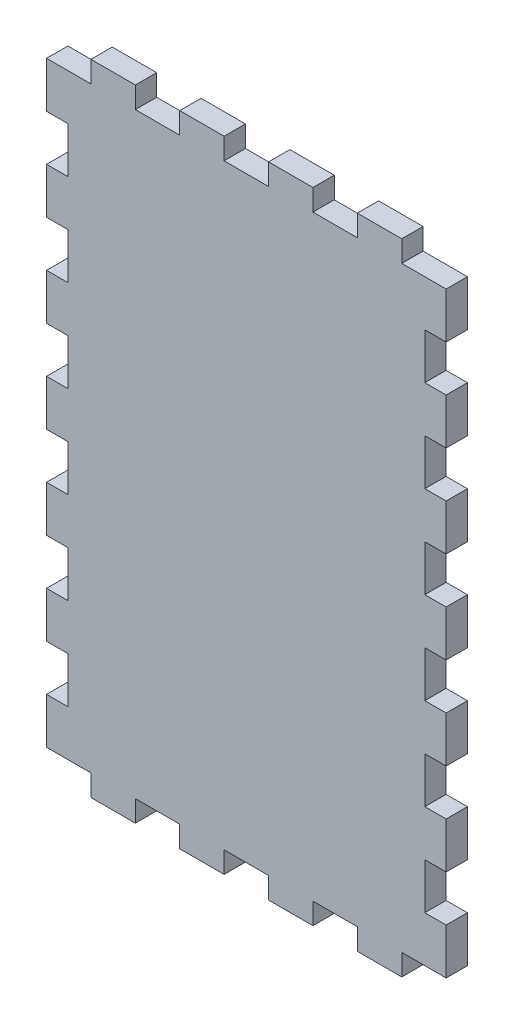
SolidWorks part; units mm, degrees
ref_plane "Front Plane" through (0, 0, 0) normal (0, 0, 1) x (1, 0, 0)
ref_plane "Top Plane" through (0, 0, 0) normal (0, 1, 0) x (1, 0, 0)
ref_plane "Right Plane" through (0, 0, 0) normal (1, 0, 0) x (0, 0, -1)
sketch "Model" plane through (0, 0, 0) normal (0, 0, 1) x (1, 0, 0)
  line L0 (83, 83) -> (87, 83)
  line L1 (87, 83) -> (87, 79)
  line L2 (87, 79) -> (95, 79)
  line L3 (95, 79) -> (95, 83)
  line L4 (95, 83) -> (103, 83)
  line L5 (103, 83) -> (103, 79)
  line L6 (103, 79) -> (111, 79)
  line L7 (111, 79) -> (111, 83)
  line L8 (111, 83) -> (119, 83)
  line L9 (119, 83) -> (119, 79)
  line L10 (119, 79) -> (127, 79)
  line L11 (127, 79) -> (127, 83)
  line L12 (127, 83) -> (135, 83)
  line L13 (135, 83) -> (135, 79)
  line L14 (135, 79) -> (143, 79)
  line L15 (143, 79) -> (143, 83)
  line L16 (143, 83) -> (151, 83)
  line L17 (151, 83) -> (151, 79)
  line L18 (151, 79) -> (159, 79)
  line L19 (159, 79) -> (159, 83)
  line L20 (159, 83) -> (167, 83)
  line L21 (167, 83) -> (167, 79)
  line L22 (167, 79) -> (175, 79)
  line L23 (175, 79) -> (175, 83)
  line L24 (175, 83) -> (183, 83)
  line L25 (183, 83) -> (183, 79)
  line L26 (183, 79) -> (191, 79)
  line L27 (191, 79) -> (191, 83)
  line L28 (191, 83) -> (195, 83)
  line L29 (195, 83) -> (195, 91.61)
  line L30 (195, 91.61) -> (199, 91.61)
  line L31 (199, 91.61) -> (199, 100.23)
  line L32 (199, 100.23) -> (195, 100.23)
  line L33 (195, 100.23) -> (195, 108.85)
  line L34 (195, 108.85) -> (199, 108.85)
  line L35 (199, 108.85) -> (199, 117.46)
  line L36 (199, 117.46) -> (195, 117.46)
  line L37 (195, 117.46) -> (195, 126.08)
  line L38 (195, 126.08) -> (199, 126.08)
  line L39 (199, 126.08) -> (199, 134.69)
  line L40 (199, 134.69) -> (195, 134.69)
  line L41 (195, 134.69) -> (195, 143.31)
  line L42 (195, 143.31) -> (199, 143.31)
  line L43 (199, 143.31) -> (199, 151.92)
  line L44 (199, 151.92) -> (195, 151.92)
  line L45 (195, 151.92) -> (195, 160.54)
  line L46 (195, 160.54) -> (199, 160.54)
  line L47 (199, 160.54) -> (199, 169.15)
  line L48 (199, 169.15) -> (195, 169.15)
  line L49 (195, 169.15) -> (195, 177.77)
  line L50 (195, 177.77) -> (199, 177.77)
  line L51 (199, 177.77) -> (199, 186.38)
  line L52 (199, 186.38) -> (195, 186.38)
  line L53 (195, 186.38) -> (195, 195)
  line L54 (195, 195) -> (191, 195)
  line L55 (191, 195) -> (191, 199)
  line L56 (191, 199) -> (183, 199)
  line L57 (183, 199) -> (183, 195)
  line L58 (183, 195) -> (175, 195)
  line L59 (175, 195) -> (175, 199)
  line L60 (175, 199) -> (167, 199)
  line L61 (167, 199) -> (167, 195)
  line L62 (167, 195) -> (159, 195)
  line L63 (159, 195) -> (159, 199)
  line L64 (159, 199) -> (151, 199)
  line L65 (151, 199) -> (151, 195)
  line L66 (151, 195) -> (143, 195)
  line L67 (143, 195) -> (143, 199)
  line L68 (143, 199) -> (135, 199)
  line L69 (135, 199) -> (135, 195)
  line L70 (135, 195) -> (127, 195)
  line L71 (127, 195) -> (127, 199)
  line L72 (127, 199) -> (119, 199)
  line L73 (119, 199) -> (119, 195)
  line L74 (119, 195) -> (111, 195)
  line L75 (111, 195) -> (111, 199)
  line L76 (111, 199) -> (103, 199)
  line L77 (103, 199) -> (103, 195)
  line L78 (103, 195) -> (95, 195)
  line L79 (95, 195) -> (95, 199)
  line L80 (95, 199) -> (87, 199)
  line L81 (87, 199) -> (87, 195)
  line L82 (87, 195) -> (83, 195)
  line L83 (83, 195) -> (83, 186.38)
  line L84 (83, 186.38) -> (79, 186.38)
  line L85 (79, 186.38) -> (79, 177.77)
  line L86 (79, 177.77) -> (83, 177.77)
  line L87 (83, 177.77) -> (83, 169.15)
  line L88 (83, 169.15) -> (79, 169.15)
  line L89 (79, 169.15) -> (79, 160.54)
  line L90 (79, 160.54) -> (83, 160.54)
  line L91 (83, 160.54) -> (83, 151.92)
  line L92 (83, 151.92) -> (79, 151.92)
  line L93 (79, 151.92) -> (79, 143.31)
  line L94 (79, 143.31) -> (83, 143.31)
  line L95 (83, 143.31) -> (83, 134.69)
  line L96 (83, 134.69) -> (79, 134.69)
  line L97 (79, 134.69) -> (79, 126.08)
  line L98 (79, 126.08) -> (83, 126.08)
  line L99 (83, 126.08) -> (83, 117.46)
  line L100 (83, 117.46) -> (79, 117.46)
  line L101 (79, 117.46) -> (79, 108.85)
  line L102 (79, 108.85) -> (83, 108.85)
  line L103 (83, 108.85) -> (83, 100.23)
  line L104 (83, 100.23) -> (79, 100.23)
  line L105 (79, 100.23) -> (79, 91.61)
  line L106 (79, 91.61) -> (83, 91.61)
  line L107 (83, 91.61) -> (83, 83)
  line L108 (83, 0) -> (91.61, 0)
  line L109 (91.61, 0) -> (91.61, 4)
  line L110 (91.61, 4) -> (100.23, 4)
  line L111 (100.23, 4) -> (100.23, 0)
  line L112 (100.23, 0) -> (108.85, 0)
  line L113 (108.85, 0) -> (108.85, 4)
  line L114 (108.85, 4) -> (117.46, 4)
  line L115 (117.46, 4) -> (117.46, 0)
  line L116 (117.46, 0) -> (126.08, 0)
  line L117 (126.08, 0) -> (126.08, 4)
  line L118 (126.08, 4) -> (134.69, 4)
  line L119 (134.69, 4) -> (134.69, 0)
  line L120 (134.69, 0) -> (143.31, 0)
  line L121 (143.31, 0) -> (143.31, 4)
  line L122 (143.31, 4) -> (151.92, 4)
  line L123 (151.92, 4) -> (151.92, 0)
  line L124 (151.92, 0) -> (160.54, 0)
  line L125 (160.54, 0) -> (160.54, 4)
  line L126 (160.54, 4) -> (169.15, 4)
  line L127 (169.15, 4) -> (169.15, 0)
  line L128 (169.15, 0) -> (177.77, 0)
  line L129 (177.77, 0) -> (177.77, 4)
  line L130 (177.77, 4) -> (186.38, 4)
  line L131 (186.38, 4) -> (186.38, 0)
  line L132 (186.38, 0) -> (195, 0)
  line L133 (195, 0) -> (199, 0)
  line L134 (199, 0) -> (199, 8.33)
  line L135 (199, 8.33) -> (195, 8.33)
  line L136 (195, 8.33) -> (195, 16.67)
  line L137 (195, 16.67) -> (199, 16.67)
  line L138 (199, 16.67) -> (199, 25)
  line L139 (199, 25) -> (195, 25)
  line L140 (195, 25) -> (195, 33.33)
  line L141 (195, 33.33) -> (199, 33.33)
  line L142 (199, 33.33) -> (199, 41.67)
  line L143 (199, 41.67) -> (195, 41.67)
  line L144 (195, 41.67) -> (195, 50)
  line L145 (195, 50) -> (199, 50)
  line L146 (199, 50) -> (199, 58.33)
  line L147 (199, 58.33) -> (195, 58.33)
  line L148 (195, 58.33) -> (195, 66.67)
  line L149 (195, 66.67) -> (199, 66.67)
  line L150 (199, 66.67) -> (199, 75)
  line L151 (199, 75) -> (191, 75)
  line L152 (191, 75) -> (191, 71)
  line L153 (191, 71) -> (183, 71)
  line L154 (183, 71) -> (183, 75)
  line L155 (183, 75) -> (175, 75)
  line L156 (175, 75) -> (175, 71)
  line L157 (175, 71) -> (167, 71)
  line L158 (167, 71) -> (167, 75)
  line L159 (167, 75) -> (159, 75)
  line L160 (159, 75) -> (159, 71)
  line L161 (159, 71) -> (151, 71)
  line L162 (151, 71) -> (151, 75)
  line L163 (151, 75) -> (143, 75)
  line L164 (143, 75) -> (143, 71)
  line L165 (143, 71) -> (135, 71)
  line L166 (135, 71) -> (135, 75)
  line L167 (135, 75) -> (127, 75)
  line L168 (127, 75) -> (127, 71)
  line L169 (127, 71) -> (119, 71)
  line L170 (119, 71) -> (119, 75)
  line L171 (119, 75) -> (111, 75)
  line L172 (111, 75) -> (111, 71)
  line L173 (111, 71) -> (103, 71)
  line L174 (103, 71) -> (103, 75)
  line L175 (103, 75) -> (95, 75)
  line L176 (95, 75) -> (95, 71)
  line L177 (95, 71) -> (87, 71)
  line L178 (87, 71) -> (87, 75)
  line L179 (87, 75) -> (79, 75)
  line L180 (79, 75) -> (79, 66.67)
  line L181 (79, 66.67) -> (83, 66.67)
  line L182 (83, 66.67) -> (83, 58.33)
  line L183 (83, 58.33) -> (79, 58.33)
  line L184 (79, 58.33) -> (79, 50)
  line L185 (79, 50) -> (83, 50)
  line L186 (83, 50) -> (83, 41.67)
  line L187 (83, 41.67) -> (79, 41.67)
  line L188 (79, 41.67) -> (79, 33.33)
  line L189 (79, 33.33) -> (83, 33.33)
  line L190 (83, 33.33) -> (83, 25)
  line L191 (83, 25) -> (79, 25)
  line L192 (79, 25) -> (79, 16.67)
  line L193 (79, 16.67) -> (83, 16.67)
  line L194 (83, 16.67) -> (83, 8.33)
  line L195 (83, 8.33) -> (79, 8.33)
  line L196 (79, 8.33) -> (79, 0)
  line L197 (79, 0) -> (83, 0)
  line L198 (83, 278) -> (91.61, 278)
  line L199 (91.61, 278) -> (91.61, 274)
  line L200 (91.61, 274) -> (100.23, 274)
  line L201 (100.23, 274) -> (100.23, 278)
  line L202 (100.23, 278) -> (108.85, 278)
  line L203 (108.85, 278) -> (108.85, 274)
  line L204 (108.85, 274) -> (117.46, 274)
  line L205 (117.46, 274) -> (117.46, 278)
  line L206 (117.46, 278) -> (126.08, 278)
  line L207 (126.08, 278) -> (126.08, 274)
  line L208 (126.08, 274) -> (134.69, 274)
  line L209 (134.69, 274) -> (134.69, 278)
  line L210 (134.69, 278) -> (143.31, 278)
  line L211 (143.31, 278) -> (143.31, 274)
  line L212 (143.31, 274) -> (151.92, 274)
  line L213 (151.92, 274) -> (151.92, 278)
  line L214 (151.92, 278) -> (160.54, 278)
  line L215 (160.54, 278) -> (160.54, 274)
  line L216 (160.54, 274) -> (169.15, 274)
  line L217 (169.15, 274) -> (169.15, 278)
  line L218 (169.15, 278) -> (177.77, 278)
  line L219 (177.77, 278) -> (177.77, 274)
  line L220 (177.77, 274) -> (186.38, 274)
  line L221 (186.38, 274) -> (186.38, 278)
  line L222 (186.38, 278) -> (195, 278)
  line L223 (195, 278) -> (199, 278)
  line L224 (199, 278) -> (199, 269.67)
  line L225 (199, 269.67) -> (195, 269.67)
  line L226 (195, 269.67) -> (195, 261.33)
  line L227 (195, 261.33) -> (199, 261.33)
  line L228 (199, 261.33) -> (199, 253)
  line L229 (199, 253) -> (195, 253)
  line L230 (195, 253) -> (195, 244.67)
  line L231 (195, 244.67) -> (199, 244.67)
  line L232 (199, 244.67) -> (199, 236.33)
  line L233 (199, 236.33) -> (195, 236.33)
  line L234 (195, 236.33) -> (195, 228)
  line L235 (195, 228) -> (199, 228)
  line L236 (199, 228) -> (199, 219.67)
  line L237 (199, 219.67) -> (195, 219.67)
  line L238 (195, 219.67) -> (195, 211.33)
  line L239 (195, 211.33) -> (199, 211.33)
  line L240 (199, 211.33) -> (199, 203)
  line L241 (199, 203) -> (191, 203)
  line L242 (191, 203) -> (191, 207)
  line L243 (191, 207) -> (183, 207)
  line L244 (183, 207) -> (183, 203)
  line L245 (183, 203) -> (175, 203)
  line L246 (175, 203) -> (175, 207)
  line L247 (175, 207) -> (167, 207)
  line L248 (167, 207) -> (167, 203)
  line L249 (167, 203) -> (159, 203)
  line L250 (159, 203) -> (159, 207)
  line L251 (159, 207) -> (151, 207)
  line L252 (151, 207) -> (151, 203)
  line L253 (151, 203) -> (143, 203)
  line L254 (143, 203) -> (143, 207)
  line L255 (143, 207) -> (135, 207)
  line L256 (135, 207) -> (135, 203)
  line L257 (135, 203) -> (127, 203)
  line L258 (127, 203) -> (127, 207)
  line L259 (127, 207) -> (119, 207)
  line L260 (119, 207) -> (119, 203)
  line L261 (119, 203) -> (111, 203)
  line L262 (111, 203) -> (111, 207)
  line L263 (111, 207) -> (103, 207)
  line L264 (103, 207) -> (103, 203)
  line L265 (103, 203) -> (95, 203)
  line L266 (95, 203) -> (95, 207)
  line L267 (95, 207) -> (87, 207)
  line L268 (87, 207) -> (87, 203)
  line L269 (87, 203) -> (79, 203)
  line L270 (79, 203) -> (79, 211.33)
  line L271 (79, 211.33) -> (83, 211.33)
  line L272 (83, 211.33) -> (83, 219.67)
  line L273 (83, 219.67) -> (79, 219.67)
  line L274 (79, 219.67) -> (79, 228)
  line L275 (79, 228) -> (83, 228)
  line L276 (83, 228) -> (83, 236.33)
  line L277 (83, 236.33) -> (79, 236.33)
  line L278 (79, 236.33) -> (79, 244.67)
  line L279 (79, 244.67) -> (83, 244.67)
  line L280 (83, 244.67) -> (83, 253)
  line L281 (83, 253) -> (79, 253)
  line L282 (79, 253) -> (79, 261.33)
  line L283 (79, 261.33) -> (83, 261.33)
  line L284 (83, 261.33) -> (83, 269.67)
  line L285 (83, 269.67) -> (79, 269.67)
  line L286 (79, 269.67) -> (79, 278)
  line L287 (79, 278) -> (83, 278)
  line L288 (0, 83) -> (0, 91.61)
  line L289 (0, 91.61) -> (4, 91.61)
  line L290 (4, 91.61) -> (4, 100.23)
  line L291 (4, 100.23) -> (0, 100.23)
  line L292 (0, 100.23) -> (0, 108.85)
  line L293 (0, 108.85) -> (4, 108.85)
  line L294 (4, 108.85) -> (4, 117.46)
  line L295 (4, 117.46) -> (0, 117.46)
  line L296 (0, 117.46) -> (0, 126.08)
  line L297 (0, 126.08) -> (4, 126.08)
  line L298 (4, 126.08) -> (4, 134.69)
  line L299 (4, 134.69) -> (0, 134.69)
  line L300 (0, 134.69) -> (0, 143.31)
  line L301 (0, 143.31) -> (4, 143.31)
  line L302 (4, 143.31) -> (4, 151.92)
  line L303 (4, 151.92) -> (0, 151.92)
  line L304 (0, 151.92) -> (0, 160.54)
  line L305 (0, 160.54) -> (4, 160.54)
  line L306 (4, 160.54) -> (4, 169.15)
  line L307 (4, 169.15) -> (0, 169.15)
  line L308 (0, 169.15) -> (0, 177.77)
  line L309 (0, 177.77) -> (4, 177.77)
  line L310 (4, 177.77) -> (4, 186.38)
  line L311 (4, 186.38) -> (0, 186.38)
  line L312 (0, 186.38) -> (0, 195)
  line L313 (0, 195) -> (8.33, 195)
  line L314 (8.33, 195) -> (8.33, 199)
  line L315 (8.33, 199) -> (16.67, 199)
  line L316 (16.67, 199) -> (16.67, 195)
  line L317 (16.67, 195) -> (25, 195)
  line L318 (25, 195) -> (25, 199)
  line L319 (25, 199) -> (33.33, 199)
  line L320 (33.33, 199) -> (33.33, 195)
  line L321 (33.33, 195) -> (41.67, 195)
  line L322 (41.67, 195) -> (41.67, 199)
  line L323 (41.67, 199) -> (50, 199)
  line L324 (50, 199) -> (50, 195)
  line L325 (50, 195) -> (58.33, 195)
  line L326 (58.33, 195) -> (58.33, 199)
  line L327 (58.33, 199) -> (66.67, 199)
  line L328 (66.67, 199) -> (66.67, 195)
  line L329 (66.67, 195) -> (75, 195)
  line L330 (75, 195) -> (75, 186.38)
  line L331 (75, 186.38) -> (71, 186.38)
  line L332 (71, 186.38) -> (71, 177.77)
  line L333 (71, 177.77) -> (75, 177.77)
  line L334 (75, 177.77) -> (75, 169.15)
  line L335 (75, 169.15) -> (71, 169.15)
  line L336 (71, 169.15) -> (71, 160.54)
  line L337 (71, 160.54) -> (75, 160.54)
  line L338 (75, 160.54) -> (75, 151.92)
  line L339 (75, 151.92) -> (71, 151.92)
  line L340 (71, 151.92) -> (71, 143.31)
  line L341 (71, 143.31) -> (75, 143.31)
  line L342 (75, 143.31) -> (75, 134.69)
  line L343 (75, 134.69) -> (71, 134.69)
  line L344 (71, 134.69) -> (71, 126.08)
  line L345 (71, 126.08) -> (75, 126.08)
  line L346 (75, 126.08) -> (75, 117.46)
  line L347 (75, 117.46) -> (71, 117.46)
  line L348 (71, 117.46) -> (71, 108.85)
  line L349 (71, 108.85) -> (75, 108.85)
  line L350 (75, 108.85) -> (75, 100.23)
  line L351 (75, 100.23) -> (71, 100.23)
  line L352 (71, 100.23) -> (71, 91.61)
  line L353 (71, 91.61) -> (75, 91.61)
  line L354 (75, 91.61) -> (75, 83)
  line L355 (75, 83) -> (66.67, 83)
  line L356 (66.67, 83) -> (66.67, 79)
  line L357 (66.67, 79) -> (58.33, 79)
  line L358 (58.33, 79) -> (58.33, 83)
  line L359 (58.33, 83) -> (50, 83)
  line L360 (50, 83) -> (50, 79)
  line L361 (50, 79) -> (41.67, 79)
  line L362 (41.67, 79) -> (41.67, 83)
  line L363 (41.67, 83) -> (33.33, 83)
  line L364 (33.33, 83) -> (33.33, 79)
  line L365 (33.33, 79) -> (25, 79)
  line L366 (25, 79) -> (25, 83)
  line L367 (25, 83) -> (16.67, 83)
  line L368 (16.67, 83) -> (16.67, 79)
  line L369 (16.67, 79) -> (8.33, 79)
  line L370 (8.33, 79) -> (8.33, 83)
  line L371 (8.33, 83) -> (0, 83)
  line L372 (278, 83) -> (278, 91.61)
  line L373 (278, 91.61) -> (274, 91.61)
  line L374 (274, 91.61) -> (274, 100.23)
  line L375 (274, 100.23) -> (278, 100.23)
  line L376 (278, 100.23) -> (278, 108.85)
  line L377 (278, 108.85) -> (274, 108.85)
  line L378 (274, 108.85) -> (274, 117.46)
  line L379 (274, 117.46) -> (278, 117.46)
  line L380 (278, 117.46) -> (278, 126.08)
  line L381 (278, 126.08) -> (274, 126.08)
  line L382 (274, 126.08) -> (274, 134.69)
  line L383 (274, 134.69) -> (278, 134.69)
  line L384 (278, 134.69) -> (278, 143.31)
  line L385 (278, 143.31) -> (274, 143.31)
  line L386 (274, 143.31) -> (274, 151.92)
  line L387 (274, 151.92) -> (278, 151.92)
  line L388 (278, 151.92) -> (278, 160.54)
  line L389 (278, 160.54) -> (274, 160.54)
  line L390 (274, 160.54) -> (274, 169.15)
  line L391 (274, 169.15) -> (278, 169.15)
  line L392 (278, 169.15) -> (278, 177.77)
  line L393 (278, 177.77) -> (274, 177.77)
  line L394 (274, 177.77) -> (274, 186.38)
  line L395 (274, 186.38) -> (278, 186.38)
  line L396 (278, 186.38) -> (278, 195)
  line L397 (278, 195) -> (269.67, 195)
  line L398 (269.67, 195) -> (269.67, 199)
  line L399 (269.67, 199) -> (261.33, 199)
  line L400 (261.33, 199) -> (261.33, 195)
  line L401 (261.33, 195) -> (253, 195)
  line L402 (253, 195) -> (253, 199)
  line L403 (253, 199) -> (244.67, 199)
  line L404 (244.67, 199) -> (244.67, 195)
  line L405 (244.67, 195) -> (236.33, 195)
  line L406 (236.33, 195) -> (236.33, 199)
  line L407 (236.33, 199) -> (228, 199)
  line L408 (228, 199) -> (228, 195)
  line L409 (228, 195) -> (219.67, 195)
  line L410 (219.67, 195) -> (219.67, 199)
  line L411 (219.67, 199) -> (211.33, 199)
  line L412 (211.33, 199) -> (211.33, 195)
  line L413 (211.33, 195) -> (203, 195)
  line L414 (203, 195) -> (203, 186.38)
  line L415 (203, 186.38) -> (207, 186.38)
  line L416 (207, 186.38) -> (207, 177.77)
  line L417 (207, 177.77) -> (203, 177.77)
  line L418 (203, 177.77) -> (203, 169.15)
  line L419 (203, 169.15) -> (207, 169.15)
  line L420 (207, 169.15) -> (207, 160.54)
  line L421 (207, 160.54) -> (203, 160.54)
  line L422 (203, 160.54) -> (203, 151.92)
  line L423 (203, 151.92) -> (207, 151.92)
  line L424 (207, 151.92) -> (207, 143.31)
  line L425 (207, 143.31) -> (203, 143.31)
  line L426 (203, 143.31) -> (203, 134.69)
  line L427 (203, 134.69) -> (207, 134.69)
  line L428 (207, 134.69) -> (207, 126.08)
  line L429 (207, 126.08) -> (203, 126.08)
  line L430 (203, 126.08) -> (203, 117.46)
  line L431 (203, 117.46) -> (207, 117.46)
  line L432 (207, 117.46) -> (207, 108.85)
  line L433 (207, 108.85) -> (203, 108.85)
  line L434 (203, 108.85) -> (203, 100.23)
  line L435 (203, 100.23) -> (207, 100.23)
  line L436 (207, 100.23) -> (207, 91.61)
  line L437 (207, 91.61) -> (203, 91.61)
  line L438 (203, 91.61) -> (203, 83)
  line L439 (203, 83) -> (211.33, 83)
  line L440 (211.33, 83) -> (211.33, 79)
  line L441 (211.33, 79) -> (219.67, 79)
  line L442 (219.67, 79) -> (219.67, 83)
  line L443 (219.67, 83) -> (228, 83)
  line L444 (228, 83) -> (228, 79)
  line L445 (228, 79) -> (236.33, 79)
  line L446 (236.33, 79) -> (236.33, 83)
  line L447 (236.33, 83) -> (244.67, 83)
  line L448 (244.67, 83) -> (244.67, 79)
  line L449 (244.67, 79) -> (253, 79)
  line L450 (253, 79) -> (253, 83)
  line L451 (253, 83) -> (261.33, 83)
  line L452 (261.33, 83) -> (261.33, 79)
  line L453 (261.33, 79) -> (269.67, 79)
  line L454 (269.67, 79) -> (269.67, 83)
  line L455 (269.67, 83) -> (278, 83)
  line L456 (83, 286) -> (91.61, 286)
  line L457 (91.61, 286) -> (91.61, 282)
  line L458 (91.61, 282) -> (100.23, 282)
  line L459 (100.23, 282) -> (100.23, 286)
  line L460 (100.23, 286) -> (108.85, 286)
  line L461 (108.85, 286) -> (108.85, 282)
  line L462 (108.85, 282) -> (117.46, 282)
  line L463 (117.46, 282) -> (117.46, 286)
  line L464 (117.46, 286) -> (126.08, 286)
  line L465 (126.08, 286) -> (126.08, 282)
  line L466 (126.08, 282) -> (134.69, 282)
  line L467 (134.69, 282) -> (134.69, 286)
  line L468 (134.69, 286) -> (143.31, 286)
  line L469 (143.31, 286) -> (143.31, 282)
  line L470 (143.31, 282) -> (151.92, 282)
  line L471 (151.92, 282) -> (151.92, 286)
  line L472 (151.92, 286) -> (160.54, 286)
  line L473 (160.54, 286) -> (160.54, 282)
  line L474 (160.54, 282) -> (169.15, 282)
  line L475 (169.15, 282) -> (169.15, 286)
  line L476 (169.15, 286) -> (177.77, 286)
  line L477 (177.77, 286) -> (177.77, 282)
  line L478 (177.77, 282) -> (186.38, 282)
  line L479 (186.38, 282) -> (186.38, 286)
  line L480 (186.38, 286) -> (195, 286)
  line L481 (195, 286) -> (195, 294.62)
  line L482 (195, 294.62) -> (199, 294.62)
  line L483 (199, 294.62) -> (199, 303.23)
  line L484 (199, 303.23) -> (195, 303.23)
  line L485 (195, 303.23) -> (195, 311.85)
  line L486 (195, 311.85) -> (199, 311.85)
  line L487 (199, 311.85) -> (199, 320.46)
  line L488 (199, 320.46) -> (195, 320.46)
  line L489 (195, 320.46) -> (195, 329.08)
  line L490 (195, 329.08) -> (199, 329.08)
  line L491 (199, 329.08) -> (199, 337.69)
  line L492 (199, 337.69) -> (195, 337.69)
  line L493 (195, 337.69) -> (195, 346.31)
  line L494 (195, 346.31) -> (199, 346.31)
  line L495 (199, 346.31) -> (199, 354.92)
  line L496 (199, 354.92) -> (195, 354.92)
  line L497 (195, 354.92) -> (195, 363.54)
  line L498 (195, 363.54) -> (199, 363.54)
  line L499 (199, 363.54) -> (199, 372.15)
  line L500 (199, 372.15) -> (195, 372.15)
  line L501 (195, 372.15) -> (195, 380.77)
  line L502 (195, 380.77) -> (199, 380.77)
  line L503 (199, 380.77) -> (199, 389.38)
  line L504 (199, 389.38) -> (195, 389.38)
  line L505 (195, 389.38) -> (195, 398)
  line L506 (195, 398) -> (186.38, 398)
  line L507 (186.38, 398) -> (186.38, 402)
  line L508 (186.38, 402) -> (177.77, 402)
  line L509 (177.77, 402) -> (177.77, 398)
  line L510 (177.77, 398) -> (169.15, 398)
  line L511 (169.15, 398) -> (169.15, 402)
  line L512 (169.15, 402) -> (160.54, 402)
  line L513 (160.54, 402) -> (160.54, 398)
  line L514 (160.54, 398) -> (151.92, 398)
  line L515 (151.92, 398) -> (151.92, 402)
  line L516 (151.92, 402) -> (143.31, 402)
  line L517 (143.31, 402) -> (143.31, 398)
  line L518 (143.31, 398) -> (134.69, 398)
  line L519 (134.69, 398) -> (134.69, 402)
  line L520 (134.69, 402) -> (126.08, 402)
  line L521 (126.08, 402) -> (126.08, 398)
  line L522 (126.08, 398) -> (117.46, 398)
  line L523 (117.46, 398) -> (117.46, 402)
  line L524 (117.46, 402) -> (108.85, 402)
  line L525 (108.85, 402) -> (108.85, 398)
  line L526 (108.85, 398) -> (100.23, 398)
  line L527 (100.23, 398) -> (100.23, 402)
  line L528 (100.23, 402) -> (91.61, 402)
  line L529 (91.61, 402) -> (91.61, 398)
  line L530 (91.61, 398) -> (83, 398)
  line L531 (83, 398) -> (83, 389.38)
  line L532 (83, 389.38) -> (79, 389.38)
  line L533 (79, 389.38) -> (79, 380.77)
  line L534 (79, 380.77) -> (83, 380.77)
  line L535 (83, 380.77) -> (83, 372.15)
  line L536 (83, 372.15) -> (79, 372.15)
  line L537 (79, 372.15) -> (79, 363.54)
  line L538 (79, 363.54) -> (83, 363.54)
  line L539 (83, 363.54) -> (83, 354.92)
  line L540 (83, 354.92) -> (79, 354.92)
  line L541 (79, 354.92) -> (79, 346.31)
  line L542 (79, 346.31) -> (83, 346.31)
  line L543 (83, 346.31) -> (83, 337.69)
  line L544 (83, 337.69) -> (79, 337.69)
  line L545 (79, 337.69) -> (79, 329.08)
  line L546 (79, 329.08) -> (83, 329.08)
  line L547 (83, 329.08) -> (83, 320.46)
  line L548 (83, 320.46) -> (79, 320.46)
  line L549 (79, 320.46) -> (79, 311.85)
  line L550 (79, 311.85) -> (83, 311.85)
  line L551 (83, 311.85) -> (83, 303.23)
  line L552 (83, 303.23) -> (79, 303.23)
  line L553 (79, 303.23) -> (79, 294.62)
  line L554 (79, 294.62) -> (83, 294.62)
  line L555 (83, 294.62) -> (83, 286)
extrude "Boss-Extrude1" add sketch "Model" along normal blind 4 contours L371 L370 L369 L368 L367 L366 L365 L364 L363 L362 L361 L360 L359 L358 L357 L356 L355 L354 L353 L352 L351 L350 L349 L348 L347 L346 L345 L344 L343 L342 L341 L340 L339 L338 L337 L336 L335 L334 L333 L332 L331 L330 L329 L328 L327 L326 L325 L324 L323 L322 L321
